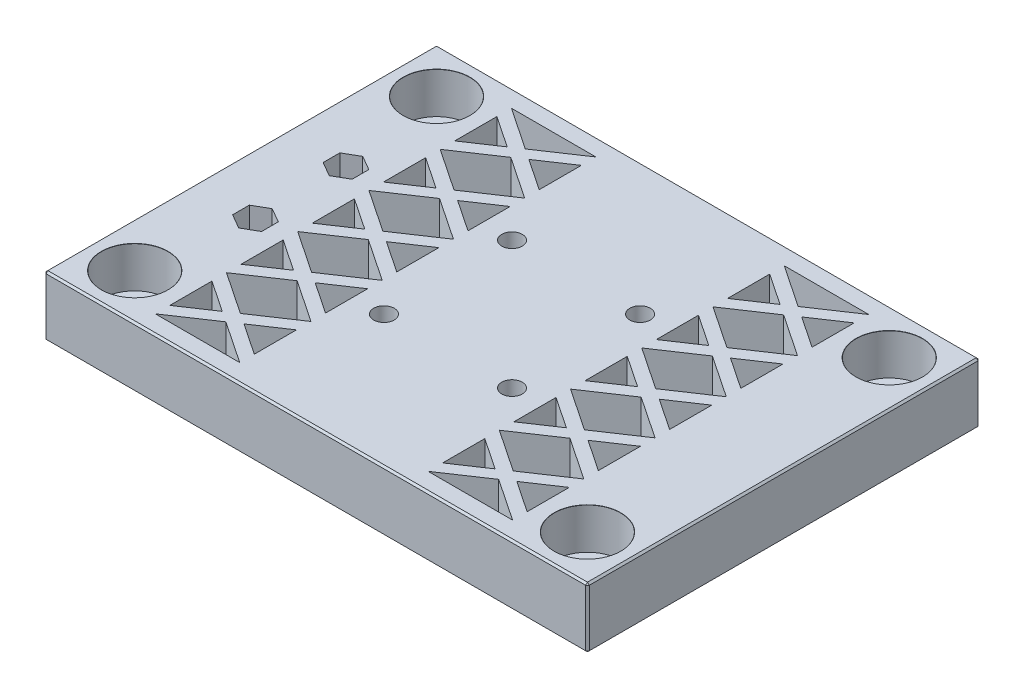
SolidWorks part; units mm, degrees
ref_plane "前视基准面" through (0, 0, 0) normal (0, 0, 1) x (1, 0, 0)
ref_plane "上视基准面" through (0, 0, 0) normal (0, 1, 0) x (1, 0, 0)
ref_plane "右视基准面" through (0, 0, 0) normal (1, 0, 0) x (0, 0, -1)
other "Configuration Table"
sketch "草图1" plane through (0, 0, 0) normal (0, 0, 1) x (1, 0, 0)
  line L1 (-45, 5) -> (45, 5)
  line L2 (-45, 5) -> (-45, -5)
  line L3 (-45, -5) -> (45, -5)
  line L4 (45, 5) -> (45, -5)
  line L5 (-45, 5) -> (45, -5) construction
  line L6 (-45, -5) -> (45, 5) construction
  point P0 (0, 0)
  dimension "D1" = 10
  dimension "D2" = 90
extrude "凸台-拉伸1" add sketch "草图1" along normal mid plane 65
hole_wizard "M3 六角圆柱头螺钉的柱形沉头孔1" positions "草图2" profile "草图3" counterbore size "M3" standard "GB"
sketch "草图2" plane through (0, -5, 0) normal (0, -1, 0) x (-1, 0, 0)
  line L1 (10.6066, -10.6066) -> (-10.6066, -10.6066)
  line L2 (10.6066, -10.6066) -> (10.6066, 10.6066)
  line L3 (10.6066, 10.6066) -> (-10.6066, 10.6066)
  line L4 (-10.6066, -10.6066) -> (-10.6066, 10.6066)
  line L5 (10.6066, -10.6066) -> (-10.6066, 10.6066) construction
  line L6 (10.6066, 10.6066) -> (-10.6066, -10.6066) construction
  circle A0 centre (0, 0) radius 15 construction
  dimension "D1" = 30
sketch "草图3" plane through (10.6066, -5, 10.6066) normal (1, 0, 0) x (0, 0, -1)
  line L0 (0, 0) -> (0, 10)
  line L1 (0, 10) -> (1.7, 10)
  line L3 (1.7, 10) -> (1.7, 4)
  line L4 (3, 4) -> (1.7, 4)
  line L5 (3, 4) -> (3, 0.025)
  line L6 (3, 0.025) -> (3.025, 0)
  line L7 (3.025, 0) -> (0, 0)
  line L8 (-3, 0.025) -> (-3.025, 0) construction
  line L11 (0, -6.35) -> (0, 107.95) construction
  dimension "通孔孔直径" = 3.4
  dimension "通孔孔深度" = 10
  dimension "柱形沉头孔直径" = 6
  dimension "柱形沉头孔深度" = 4
  dimension "近端锥形沉头孔直径" = 6.05
  dimension "近端锥形沉头孔角度" = 90
hole_wizard "M6 六角圆柱头螺钉的柱形沉头孔1" positions "草图4" profile "草图5" counterbore size "M6" standard "GB"
sketch "草图4" plane through (0, 5, 0) normal (0, 1, 0) x (1, 0, 0)
  line L1 (37.5, -25) -> (-37.5, -25)
  line L2 (37.5, -25) -> (37.5, 25)
  line L3 (37.5, 25) -> (-37.5, 25)
  line L4 (-37.5, -25) -> (-37.5, 25)
  line L5 (37.5, -25) -> (-37.5, 25) construction
  line L6 (37.5, 25) -> (-37.5, -25) construction
  point P3 (0, 0)
  dimension "D1" = 75
  dimension "D2" = 50
sketch "草图5" plane through (-37.5, 5, 25) normal (1, 0, 0) x (0, 0, 1)
  line L0 (0, 0) -> (0, 10)
  line L1 (0, 10) -> (3.3, 10)
  line L3 (3.3, 10) -> (3.3, 6.8)
  line L4 (5.5, 6.8) -> (3.3, 6.8)
  line L5 (5.5, 6.8) -> (5.5, 0.025)
  line L6 (5.5, 0.025) -> (5.525, 0)
  line L7 (5.525, 0) -> (0, 0)
  line L8 (-5.5, 0.025) -> (-5.525, 0) construction
  line L11 (0, -6.35) -> (0, 107.95) construction
  dimension "通孔孔直径" = 6.6
  dimension "通孔孔深度" = 10
  dimension "柱形沉头孔直径" = 11
  dimension "柱形沉头孔深度" = 6.8
  dimension "近端锥形沉头孔直径" = 11.05
  dimension "近端锥形沉头孔角度" = 90
chamfer "倒角1" distance 0.3 angle 45 12 edges at (-45, 5, 0) (-45, -5, 0) (0, -5, 32.5) (-45, 0, 32.5) (0, 5, 32.5) (45, -5, 0) (45, 0, 32.5) (45, 5, 0) (0, 5, -32.5) (-45, 0, -32.5) (0, -5, -32.5) (45, 0, -32.5)
sketch "草图6" plane through (0, 5, 0) normal (0, 1, 0) x (1, 0, 0)
  line L0 (0, 0) -> (-54.8913, 0) construction
  line L1 (-35, 4.7287) -> (-32.6, 6.1144)
  line L2 (-32.6, 6.1144) -> (-32.6, 8.8856)
  line L3 (-32.6, 8.8856) -> (-35, 10.2713)
  line L4 (-35, 10.2713) -> (-37.4, 8.8856)
  line L5 (-37.4, 8.8856) -> (-37.4, 6.1144)
  line L6 (-37.4, 6.1144) -> (-35, 4.7287)
  line L7 (-37.4, -6.1144) -> (-35, -4.7287)
  line L8 (-37.4, -8.8856) -> (-37.4, -6.1144)
  line L9 (-35, -10.2713) -> (-37.4, -8.8856)
  line L10 (-32.6, -8.8856) -> (-35, -10.2713)
  line L11 (-32.6, -6.1144) -> (-32.6, -8.8856)
  line L12 (-35, -4.7287) -> (-32.6, -6.1144)
  line L13 (-45, -32.2) -> (-45, 32.2) construction
  circle A0 centre (-35, 7.5) radius 2.4 construction
  circle A1 centre (-35, -7.5) radius 2.4 construction
  point P21 (0, 0)
  dimension "D1" = 15
  dimension "D2" = 10
  dimension "D3" = 4.8
extrude "切除-拉伸1" cut sketch "草图6" against normal blind 6
sketch "草图7" plane through (0, 5, 0) normal (0, 1, 0) x (1, 0, 0)
  line L0 (0, 0) -> (0, 54.5027) construction
  line L1 (-15.6, -29.5) -> (-29.6, -29.5)
  line L2 (-15.6, -29.5) -> (-15.6, 29.5)
  line L3 (-15.6, 29.5) -> (-29.6, 29.5)
  line L4 (-29.6, -29.5) -> (-29.6, 29.5)
  line L5 (-15.6, -29.5) -> (-29.6, 29.5) construction
  line L6 (-15.6, 29.5) -> (-29.6, -29.5) construction
  line L7 (-32.6, 6.1144) -> (-32.6, 8.8856) construction
  line L8 (-44.7, 32.5) -> (44.7, 32.5) construction
  line L9 (44.7, -32.5) -> (-44.7, -32.5) construction
  point P0 (-22.6, 0)
  dimension "D1" = 3
  dimension "D2" = 14
  dimension "D3" = 3
  dimension "D4" = 3
extrude "切除-拉伸2" cut sketch "草图7" against normal up to next
sketch "草图8" plane through (0, 5, 0) normal (0, 1, 0) x (1, 0, 0)
  line L0 (-29.6, 29.5) -> (-29.6, 27.0917)
  line L1 (-29.6, 29.5) -> (-29.6, -29.5) construction
  line L2 (-29.6, 27.0917) -> (-15.6, 17.7)
  line L3 (-15.6, -29.5) -> (-15.6, 29.5) construction
  line L4 (-15.6, 17.7) -> (-15.6, 20.1083)
  line L5 (-15.6, 20.1083) -> (-29.6, 29.5)
  line L6 (-15.6, 29.5) -> (-15.6, 27.0917)
  line L7 (-15.6, 27.0917) -> (-29.6, 17.7)
  line L8 (-29.6, 17.7) -> (-29.6, 20.1083)
  line L9 (-29.6, 20.1083) -> (-15.6, 29.5)
  line L10 (-29.6, 17.7) -> (-29.6, 15.2917)
  line L11 (-29.6, 15.2917) -> (-15.6, 5.9)
  line L12 (-15.6, 5.9) -> (-15.6, 8.3083)
  line L13 (-15.6, 8.3083) -> (-29.6, 17.7)
  line L14 (-15.6, 17.7) -> (-15.6, 15.2917)
  line L15 (-15.6, 15.2917) -> (-29.6, 5.9)
  line L16 (-29.6, 5.9) -> (-29.6, 8.3083)
  line L17 (-29.6, 8.3083) -> (-15.6, 17.7)
  line L18 (-29.6, 5.9) -> (-29.6, 3.4917)
  line L19 (-29.6, 3.4917) -> (-15.6, -5.9)
  line L20 (-15.6, -5.9) -> (-15.6, -3.4917)
  line L21 (-15.6, -3.4917) -> (-29.6, 5.9)
  line L22 (-15.6, 5.9) -> (-15.6, 3.4917)
  line L23 (-15.6, 3.4917) -> (-29.6, -5.9)
  line L24 (-29.6, -5.9) -> (-29.6, -3.4917)
  line L25 (-29.6, -3.4917) -> (-15.6, 5.9)
  line L26 (-29.6, -5.9) -> (-29.6, -8.3083)
  line L27 (-29.6, -8.3083) -> (-15.6, -17.7)
  line L28 (-15.6, -17.7) -> (-15.6, -15.2917)
  line L29 (-15.6, -15.2917) -> (-29.6, -5.9)
  line L30 (-15.6, -5.9) -> (-15.6, -8.3083)
  line L31 (-15.6, -8.3083) -> (-29.6, -17.7)
  line L32 (-29.6, -17.7) -> (-29.6, -15.2917)
  line L33 (-29.6, -15.2917) -> (-15.6, -5.9)
  line L34 (-29.6, -17.7) -> (-29.6, -20.1083)
  line L35 (-29.6, -20.1083) -> (-15.6, -29.5)
  line L36 (-15.6, -29.5) -> (-15.6, -27.0917)
  line L37 (-15.6, -27.0917) -> (-29.6, -17.7)
  line L38 (-15.6, -17.7) -> (-15.6, -20.1083)
  line L39 (-15.6, -20.1083) -> (-29.6, -29.5)
  line L40 (-29.6, -29.5) -> (-29.6, -27.0917)
  line L41 (-29.6, -27.0917) -> (-15.6, -17.7)
  point P12 (-15.6, -29.5)
  point P15 (-15.6, 17.7409)
  dimension "D1" = 2
  dimension "D2" = 2
  dimension "D3" = 5
extrude "凸台-拉伸2" add sketch "草图8" against normal up to surface (10 mm away) contours L2 L9 L5 M6 | L9 L2 L7 L5 | L9 L7 L2 M6 | L9 L5 L7 M8 | L5 L7 L2 M8 | L11 L17 L13 M6 | L17 L11 L15 L13 | L17 L13 L15 M8 | L13 L15 L11 M8 | L17 L15 L11 M6 | L19 L25 L21 M6 | L25 L21 L23 M8 | L25 L19 L23 L21 | L21 L23 L19 M8 | L25 L23 L19 M6 | L27 L33 L29 M6 | L33 L29 L31 M8 | L33 L27 L31 L29 | L33 L31 L27 M6 | L29 L31 L27 M8 | L41 L37 L39 M8 | L35 L41 L37 M6 | L41 L35 L39 L37 | L41 L39 L35 M6 | L37 L39 L35 M8
mirror "镜向1" about plane through (0, 0, 0) normal (1, 0, 0) of "切除-拉伸2", "凸台-拉伸2"
